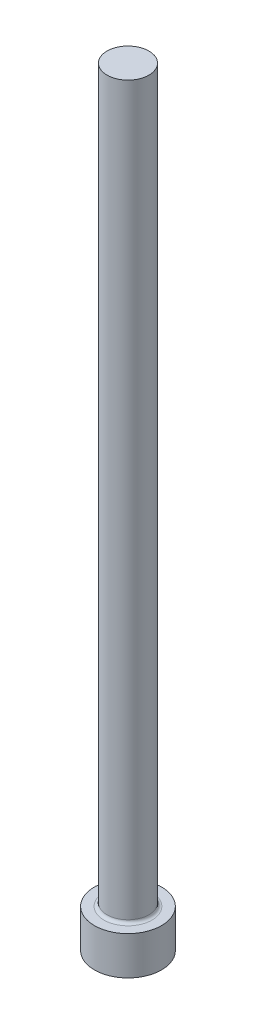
SolidWorks part; units mm, degrees
ref_plane "Front Plane" through (0, 0, 0) normal (0, 0, 1) x (1, 0, 0)
ref_plane "Top Plane" through (0, 0, 0) normal (0, 1, 0) x (1, 0, 0)
ref_plane "Right Plane" through (0, 0, 0) normal (1, 0, 0) x (0, 0, -1)
sketch "Sketch1" plane through (0, 0, 0) normal (0, 0, 1) x (1, 0, 0)
  line L0 (0, 0) -> (0, -1.906) construction
  line L1 (0, 0) -> (2.7686, 0)
  line L2 (2.7686, 0) -> (2.7686, 3.175)
  line L3 (2.7686, 3.175) -> (1.9812, 3.175)
  line L4 (1.7272, 3.429) -> (1.7272, 63.5)
  line L6 (0, 63.5) -> (1.7272, 63.5)
  line L7 (0, 63.5) -> (0, 0)
  arc A0 (1.9812, 3.175) -> (1.7272, 3.429) centre (1.9812, 3.429) cw
  dimension "D5" = 0.254
  dimension "D" = 3.4544
  dimension "H" = 5.5372
  dimension "D4" = 63.5
  dimension "T" = 3.175
revolve "Revolve3" add sketch "Sketch1" angle 360 about L0
